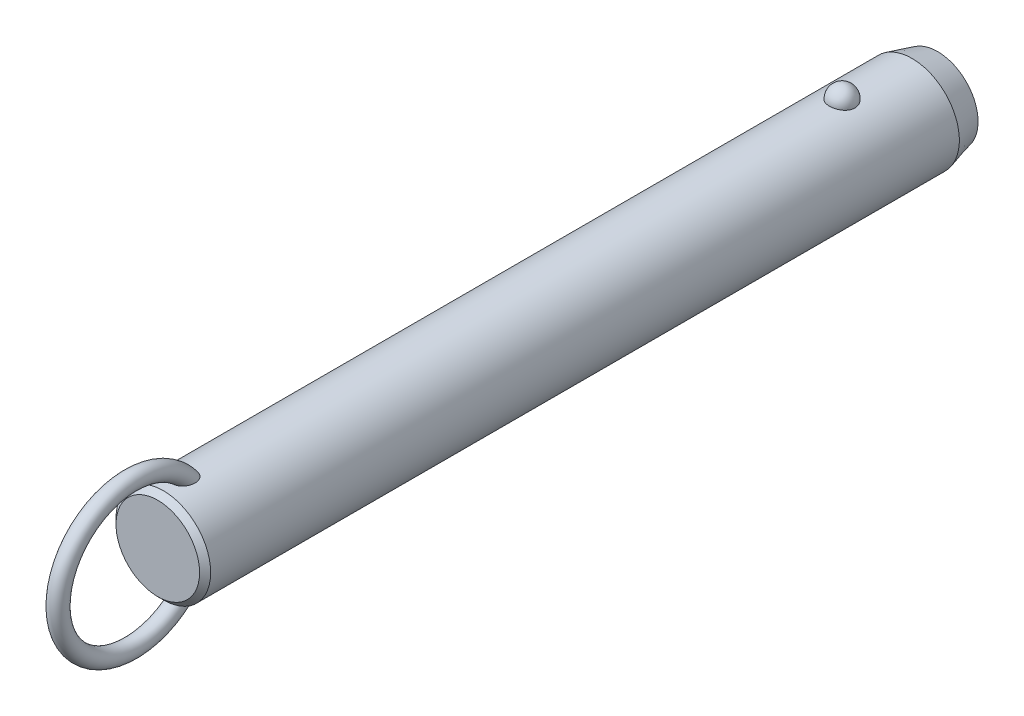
SolidWorks part; units mm, degrees
ref_plane "Front Plane" through (0, 0, 0) normal (0, 0, 1) x (1, 0, 0)
ref_plane "Top Plane" through (0, 0, 0) normal (0, 1, 0) x (1, 0, 0)
ref_plane "Right Plane" through (0, 0, 0) normal (1, 0, 0) x (0, 0, -1)
sketch "Sketch2" plane through (0, 0, 0) normal (0, 0, 1) x (1, 0, 0)
  circle A0 centre (0, 0) radius 11.1
  point P3 (0, 11.1)
  dimension "D1" = 22.2
extrude "Boss-Extrude1" add sketch "Sketch2" along normal blind 144.8
sketch "Sketch3" plane through (0, 0, 0) normal (0, 0, -1) x (-1, 0, 0)
  circle A0 centre (0, 0) radius 11.1
  dimension "D1" = 22.2
extrude "Boss-Extrude2" add sketch "Sketch3" along normal blind 25.4
chamfer "Chamfer1" distance 6 angle 15 1 edges at (-11.1, 0, -25.4)
sketch "Sketch12" plane through (0, 0, 0) normal (1, 0, 0) x (0, 0, -1)
  line L0 (-144.8, 11.1) -> (-144.8, -11.1) construction
  point P0 (-144.8, 0)
sketch "Sketch13" plane through (0, 0, 0) normal (1, 0, 0) x (0, 0, -1)
  circle A0 centre (-163.85, 0) radius 19.05
  point P2 (-144.8, 0)
  dimension "D1" = 38.1
sketch "Sketch14" plane through (0, 0, 0) normal (0, 1, 0) x (1, 0, 0)
  circle A0 centre (0, -146.8) radius 2
  point P2 (0, -144.8)
  dimension "D1" = 4
sweep "Sweep1" add profiles "Sketch14" path "Sketch13"
sketch "Sketch15" plane through (0, 0, 144.8) normal (0, 0, 1) x (1, 0, 0)
  circle A0 centre (0, 0) radius 11.1
  dimension "D1" = 22.2
extrude "Boss-Extrude3" add sketch "Sketch15" along normal blind 12.7
chamfer "Chamfer2" distance 1.3 angle 45 1 edges at (11.1, 0, 157.5)
sketch "Sketch18" plane through (0, 0, 0) normal (1, 0, 0) x (0, 0, -1)
  line L0 (19.4, 11.1) -> (-148.368, 11.1) construction
  line L1 (3, 14.1) -> (3, 8.1)
  line L2 (-148.368, -11.1) -> (19.4, -11.1) construction
  arc A0 (3, 14.1) -> (3, 8.1) centre (3, 11.1) ccw
  point P4 (0, 11.1)
  dimension "D1" = 25.2
revolve "Revolve1" add sketch "Sketch18" angle 360 about L1
